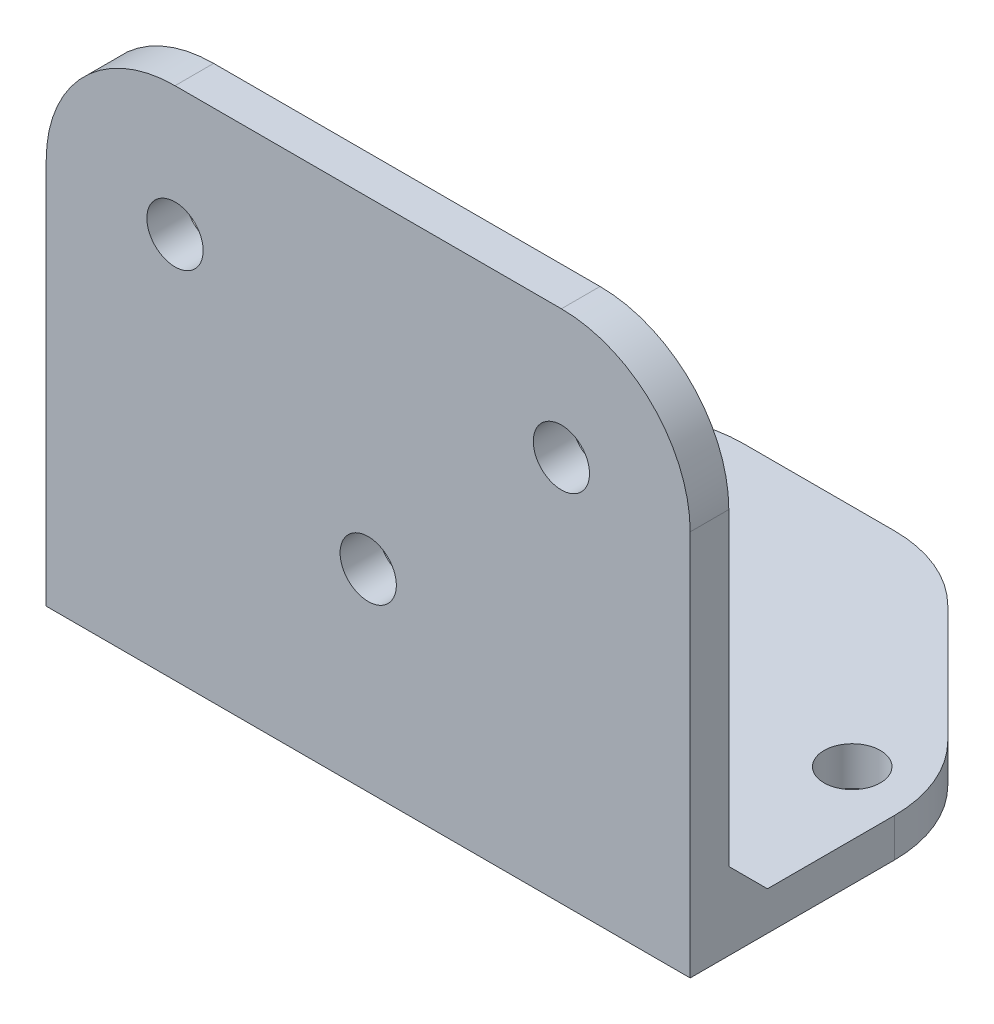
SolidWorks part; units mm, degrees
ref_plane "Front Plane" through (0, 0, 0) normal (0, 0, 1) x (1, 0, 0)
ref_plane "Top Plane" through (0, 0, 0) normal (0, 1, 0) x (1, 0, 0)
ref_plane "Right Plane" through (0, 0, 0) normal (1, 0, 0) x (0, 0, -1)
sketch "Sketch1" plane through (0, 0, 0) normal (0, 1, 0) x (1, 0, 0)
  line L0 (-20.0787, 0) -> (20.0787, 0) construction
  line L1 (-25, 17.5) -> (25, 17.5)
  line L2 (-25, 17.5) -> (-25, -17.5)
  line L3 (-25, -17.5) -> (25, -17.5)
  line L4 (25, 17.5) -> (25, -17.5)
  line L5 (-25, 17.5) -> (25, -17.5) construction
  line L6 (-25, -17.5) -> (25, 17.5) construction
  circle A0 centre (-20.0787, 0) radius 2.1844
  circle A1 centre (20.0787, 0) radius 2.1844
  circle A2 centre (0, 0) radius 15.4178 construction
  point P0 (0, 0)
  point P9 (0, 0)
extrude "Boss-Extrude1" add sketch "Sketch1" along normal blind 3
sketch "Sketch3" plane through (0, 0, 0) normal (0, -1, 0) x (1, 0, 0)
  line L0 (-25, 17.5) -> (25, 17.5)
extrude "Extrude-Thin1" add sketch "Sketch3" against normal blind 40 thin
sketch "Sketch4" plane through (0, 0, 14.5) normal (0, 0, -1) x (-1, 0, 0)
  line L0 (-25, 40) -> (25, 3) construction
  line L1 (0, 3) -> (0, 40) construction
  line L2 (25, 40) -> (-25, 40) construction
  circle A0 centre (15, 30) radius 2.1844
  circle A1 centre (0, 30) radius 2.1844
  circle A2 centre (-15, 30) radius 2.1844
  circle A3 centre (0, 15) radius 2.1844
  circle A4 centre (-15, 15) radius 2.1844
  circle A5 centre (15, 15) radius 2.1844
  point P9 (0, 21.5)
extrude "Cut-Extrude1" cut sketch "Sketch4" against normal through all
chamfer "Chamfer1" distance 3 angle 45 1 edges at (0, 3, 14.5)
chamfer "Chamfer2" distance 15 angle 45 2 edges at (-25, 1.5, -17.5) (25, 1.5, -17.5)
fillet "Fillet1" radius 10 6 edges at (-25, 40, 16) (25, 40, 16) (-25, 1.5, -2.5) (10, 1.5, -17.5) (-10, 1.5, -17.5) (25, 1.5, -2.5)
equation "\"HoleDiameter\"= 4.3688mm"
equation "\"D2@Sketch1\"=\"HoleDiameter\""
equation "\"D1@Sketch4\"=\"HoleDiameter\""
